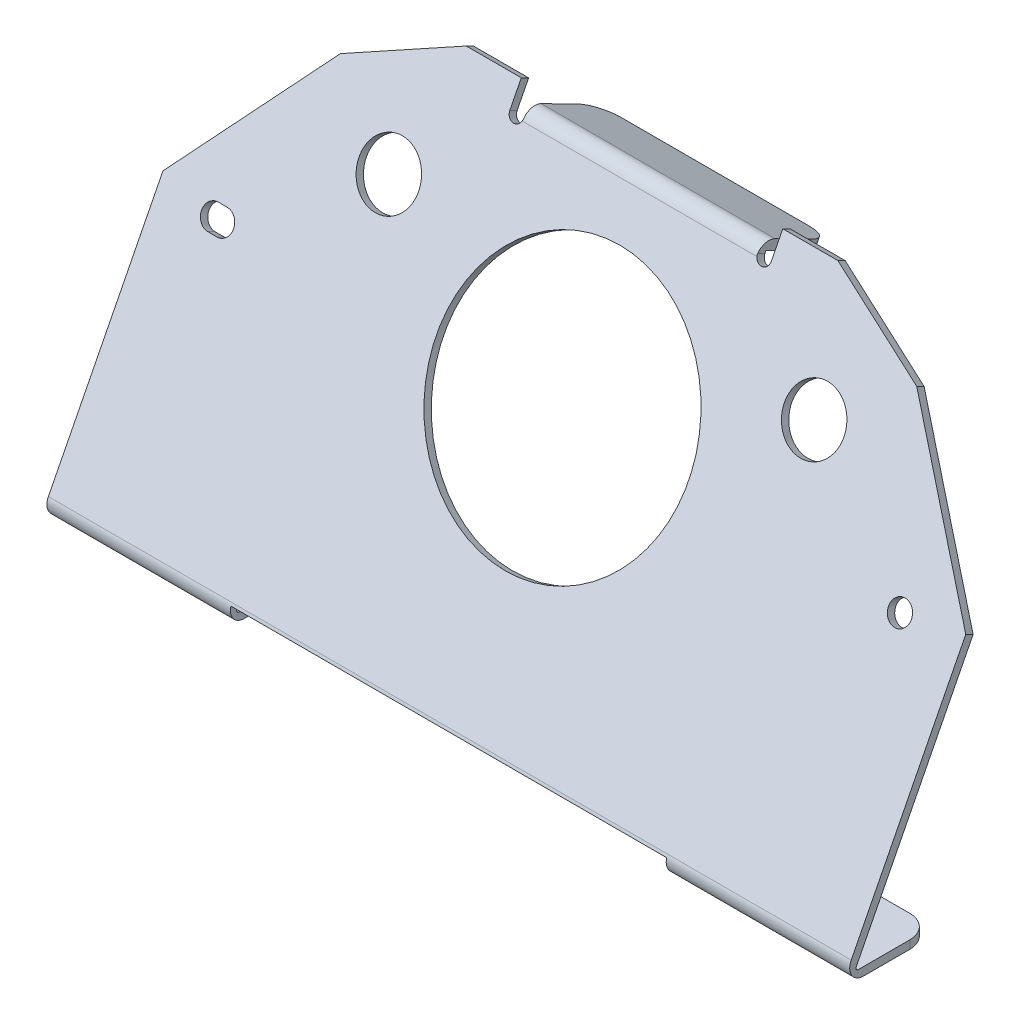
SolidWorks part; units mm, degrees
ref_plane "Plan de face" through (0, 0, 0) normal (0, 0, 1) x (1, 0, 0)
ref_plane "Plan de dessus" through (0, 0, 0) normal (0, 1, 0) x (1, 0, 0)
ref_plane "Plan de droite" through (0, 0, 0) normal (1, 0, 0) x (0, 0, -1)
sketch "Esquisse1" plane through (0, 0, 0) normal (1, 0, 0) x (0, 0, -1)
  line L0 (0, 0) -> (-20, 0)
  line L1 (-20, 0) -> (26.307, 90.8827)
  line L2 (0, 1.8) -> (-17.0627, 1.8)
  line L3 (-17.0627, 1.8) -> (27.9108, 90.0655)
  line L4 (26.307, 90.8827) -> (27.9108, 90.0655)
  line L5 (0, 1.8) -> (0, 0)
  dimension "D1" = 102
  dimension "D2" = 20
  dimension "D3" = 63
  dimension "D4" = 1.8
extrude "Extrusion1" add sketch "Esquisse1" along normal blind 175
fillet "Congé1" radius 3 1 edges at (87.5, 0, 20)
sketch "Esquisse2" plane through (0, 1.8, 0) normal (0, 1, 0) x (1, 0, 0)
  line L0 (175, -17.0627) -> (0, -17.0627) construction
  line L1 (135, -17.0627) -> (40, -17.0627)
  line L2 (175, 0) -> (0, 0) construction
  line L3 (135, 0) -> (40, 0)
  line L4 (135, -17.0627) -> (135, 0)
  line L5 (175, 0) -> (175, -17.0627) construction
  line L6 (40, -17.0627) -> (40, 0)
  line L7 (0, 0) -> (0, -17.0627) construction
  point P10 (0, -8.5313)
  dimension "D1" = 40
  dimension "D2" = 40
extrude "Extrusion2" cut sketch "Esquisse2" against normal blind 175
fillet "Congé3" radius 5 4 edges at (0, 0.9, 0) (40, 0.9, 0) (135, 0.9, 0) (175, 0.9, 0)
sketch "Esquisse3" plane through (0, 1.8, 0) normal (0, 1, 0) x (1, 0, 0)
  circle A0 centre (20, -8.3498) radius 5
  circle A1 centre (155, -8.3498) radius 5
  dimension "D1" = 10
  dimension "D2" = 10
extrude "Extrusion3" cut sketch "Esquisse3" against normal blind 175
sketch "Esquisse4" plane through (0, 8.0902, 15.8779) normal (0, 0.454, 0.891) x (1, 0, 0)
  line L0 (175, 50.8157) -> (150.3179, 81.6548)
  line L1 (175, 92.9202) -> (175, -4.1843) construction
  line L2 (150.3179, 81.6548) -> (128, 92.9202)
  line L3 (175, 92.9202) -> (0, 92.9202) construction
  line L4 (0, -4.1843) -> (175, -4.1843) construction
  line L5 (128, 92.9202) -> (128, 98.1261)
  line L6 (128, 98.1261) -> (178.6194, 98.1261)
  line L7 (178.6194, 98.1261) -> (180.2198, 50.8157)
  line L8 (180.2198, 50.8157) -> (175, 50.8157)
  line L9 (87.5, 92.9202) -> (87.5, -12.8971) construction
  line L10 (-5.2198, 50.8157) -> (0, 50.8157)
  line L11 (-3.6194, 98.1261) -> (-5.2198, 50.8157)
  line L12 (47, 98.1261) -> (-3.6194, 98.1261)
  line L13 (47, 92.9202) -> (47, 98.1261)
  line L14 (24.6821, 81.6548) -> (47, 92.9202)
  line L15 (0, 50.8157) -> (24.6821, 81.6548)
  line L17 (62, 100.9812) -> (113, 100.9812)
  line L18 (62, 100.9812) -> (62, 89.9202)
  line L19 (62, 89.9202) -> (113, 89.9202)
  line L20 (113, 100.9812) -> (113, 89.9202)
  dimension "D1" = 55
  dimension "D2" = 39.5
  dimension "D3" = 47
  dimension "D4" = 25
  dimension "D5" = 15
  dimension "D6" = 15
  dimension "D7" = 3
extrude "Extrusion4" cut sketch "Esquisse4" against normal blind 175
sketch "Esquisse5" plane through (0, 8.0902, 15.8779) normal (0, 0.454, 0.891) x (1, 0, 0)
  line L0 (62, 89.9202) -> (62, 92.9202) construction
  line L1 (59, 95.0376) -> (62, 95.0376)
  line L2 (59, 95.0376) -> (59, 85.9202)
  line L3 (59, 85.9202) -> (62, 85.9202)
  line L4 (62, 95.0376) -> (62, 85.9202)
  line L5 (62, 89.9202) -> (113, 89.9202) construction
  line L6 (113, 89.9202) -> (113, 92.9202) construction
  line L7 (113, 95.4885) -> (116, 95.4885)
  line L8 (113, 95.4885) -> (113, 85.9202)
  line L9 (113, 85.9202) -> (116, 85.9202)
  line L10 (116, 95.4885) -> (116, 85.9202)
  line L11 (87.5, 49.9202) -> (28.292, 73.8418) construction
  line L12 (87.5, 49.9202) -> (87.5, 98.5462) construction
  line L13 (87.5, 49.9202) -> (146.708, 73.8418) construction
  circle A0 centre (87.5, 49.9202) radius 27.5
  circle A1 centre (41.1408, 68.6505) radius 6.5
  circle A2 centre (133.8592, 68.6505) radius 6.5
  dimension "D7" = 40
  dimension "D8" = 55
  dimension "D12" = 13
  dimension "D13" = 13
  dimension "D1" = 3
  dimension "D2" = 0
  dimension "D3" = 4
  dimension "D4" = 0
  dimension "D5" = 3
  dimension "D6" = 4
  dimension "D9" = 68
  dimension "D10" = 50
  dimension "D11" = 50
extrude "Enlèv. mat.-Extru.1" cut sketch "Esquisse5" against normal blind 10
sketch "Esquisse6" plane through (0, 8.0902, 15.8779) normal (0, 0.454, 0.891) x (1, 0, 0)
  line L0 (113, 89.9202) -> (113, 85.9202) construction
  line L1 (62, 89.9202) -> (113, 89.9202)
  line L2 (62, 89.9202) -> (62, 87.9202)
  line L3 (62, 87.9202) -> (113, 87.9202)
  line L4 (113, 89.9202) -> (113, 87.9202)
extrude "Boss.-Extru.1" add sketch "Esquisse6" against normal blind 17
fillet "Congé4" radius 5 2 edges at (62, 79.6008, -39.6382) (113, 79.6008, -39.6382)
fillet "Congé5" radius 1.5 2 edges at (116, 84.237, -23.931) (113, 84.237, -23.931)
fillet "Congé6" radius 1.5 2 edges at (62, 84.237, -23.931) (59, 84.237, -23.931)
fillet "Congé7" radius 3 1 edges at (87.5, 88.2096, -24.9451)
sketch "Esquisse7" plane through (0, 0, 0) normal (0, 0, -1) x (-1, 0, 0)
  line L1 (-40, 0) -> (-40, 1.8) construction
  line L2 (-135, 3.8) -> (-40, 3.8)
  line L3 (-135, 3.8) -> (-135, 0)
  line L4 (-135, 0) -> (-40, 0)
  line L5 (-40, 3.8) -> (-40, 0)
  line L6 (-135, 1.8) -> (-135, 0) construction
  line L7 (-170, 1.8) -> (-140, 1.8) construction
  dimension "D1" = 0
  dimension "D2" = 0
  dimension "D3" = 2
extrude "Enlèv. mat.-Extru.2" cut sketch "Esquisse7" against normal through all
fillet "Congé8" radius 0.5 2 edges at (155, 1.8, 17.0627) (20, 1.8, 17.0627)
sketch "Esquisse8" plane through (0, 8.0902, 15.8779) normal (0, 0.454, 0.891) x (1, 0, 0)
  line L0 (0, 50.8157) -> (180.2291, 50.8157) construction
  line L1 (12, 48.4157) -> (14, 48.4157) construction
  line L2 (12, 50.9157) -> (14, 50.9157)
  line L3 (12, 45.9157) -> (14, 45.9157)
  line L4 (0, 50.8157) -> (0, -4.1843) construction
  line L5 (175, -5.3266) -> (175, 50.8157) construction
  circle A0 centre (161.7, 48.5157) radius 2.5
  arc A1 (12, 50.9157) -> (12, 45.9157) centre (12, 48.4157) ccw
  arc A2 (14, 45.9157) -> (14, 50.9157) centre (14, 48.4157) ccw
  point P7 (13, 48.4157)
  dimension "D1" = 2.3
  dimension "D3" = 2.4
  dimension "D5" = 2.5
  dimension "D4" = 13
  dimension "D7" = 5
  dimension "D2" = 13.3
  dimension "D6" = 2
extrude "Enlèv. mat.-Extru.4" cut sketch "Esquisse8" against normal through all
